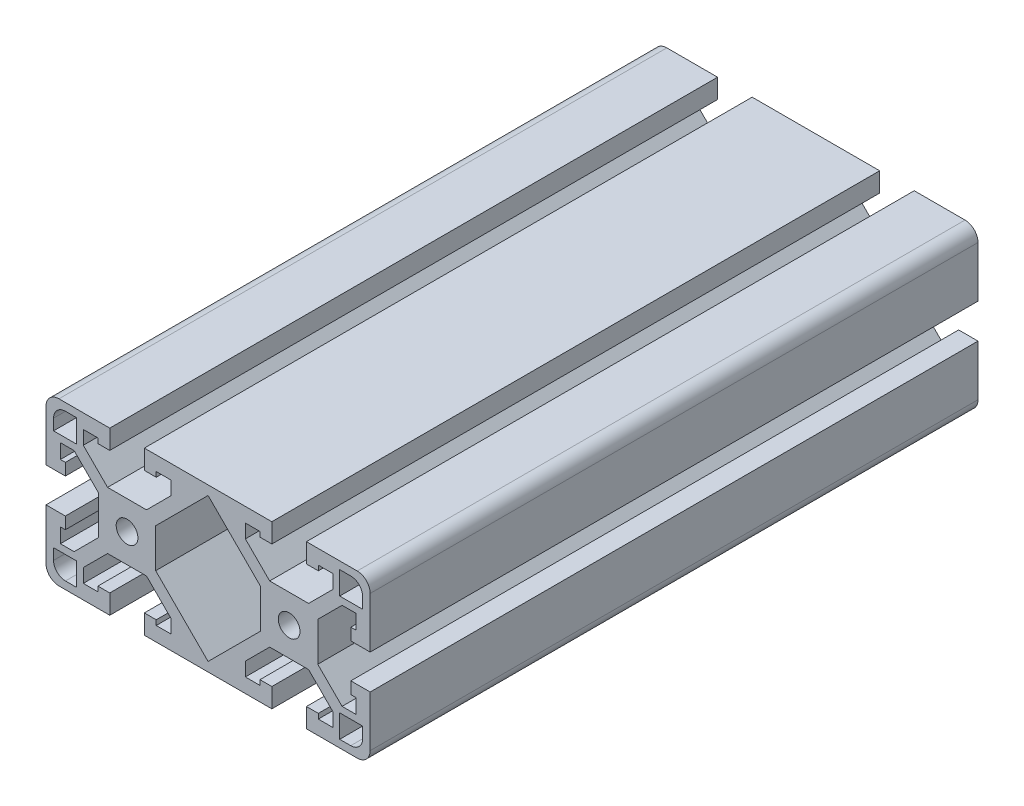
SolidWorks part; units mm, degrees
ref_plane "Front" through (0, 0, 0) normal (0, 0, 1) x (1, 0, 0)
ref_plane "Top" through (0, 0, 0) normal (0, 1, 0) x (1, 0, 0)
ref_plane "Right" through (0, 0, 0) normal (1, 0, 0) x (0, 0, -1)
sketch "Sketch1" plane through (0, 0, 0) normal (0, 0, 1) x (1, 0, 0)
  line L0 (-12.319, 4.5757) -> (-12.319, -4.5757)
  line L1 (0, 16.8947) -> (-12.319, 4.5757)
  line L2 (12.319, 4.5757) -> (0, 16.8947)
  line L3 (12.319, -4.5757) -> (12.319, 4.5757)
  line L4 (0, -16.8947) -> (12.319, -4.5757)
  line L5 (-12.319, -4.5757) -> (0, -16.8947)
  line L6 (-30.9372, 11.8872) -> (-30.9372, 17.272)
  line L7 (-36.322, 11.8872) -> (-30.9372, 11.8872)
  line L8 (-36.322, 14.478) -> (-36.322, 11.8872)
  line L9 (-30.9372, 17.272) -> (-33.528, 17.272)
  line L10 (-30.9372, -17.272) -> (-30.9372, -11.8872)
  line L11 (-33.528, -17.272) -> (-30.9372, -17.272)
  line L12 (-36.322, -11.8872) -> (-36.322, -14.478)
  line L13 (-30.9372, -11.8872) -> (-36.322, -11.8872)
  line L14 (36.322, -11.8872) -> (30.9372, -11.8872)
  line L15 (36.322, -14.478) -> (36.322, -11.8872)
  line L16 (30.9372, -17.272) -> (33.528, -17.272)
  line L17 (30.9372, -11.8872) -> (30.9372, -17.272)
  line L18 (30.9372, 17.272) -> (30.9372, 11.8872)
  line L19 (33.528, 17.272) -> (30.9372, 17.272)
  line L20 (36.322, 11.8872) -> (36.322, 14.478)
  line L21 (30.9372, 11.8872) -> (36.322, 11.8872)
  line L22 (-29.337, 12.4423) -> (-29.337, 15.6718)
  line L23 (-29.337, 15.6718) -> (-25.908, 15.6718)
  line L24 (-25.908, 15.6718) -> (-25.908, 14.5034)
  line L25 (-25.908, 14.5034) -> (-23.114, 14.5034)
  line L26 (-23.114, 14.5034) -> (-23.114, 19.05)
  line L27 (-23.114, 19.05) -> (-35.052, 19.05)
  line L28 (-38.1, 16.002) -> (-38.1, 4.064)
  line L29 (-38.1, 4.064) -> (-33.5534, 4.064)
  line L30 (-33.5534, 4.064) -> (-33.5534, 6.858)
  line L31 (-33.5534, 6.858) -> (-34.7218, 6.858)
  line L32 (-34.7218, 6.858) -> (-34.7218, 10.287)
  line L33 (-34.7218, 10.287) -> (-31.4923, 10.287)
  line L34 (-31.4923, 10.287) -> (-25.781, 4.5757)
  line L35 (-25.781, 4.5757) -> (-25.781, -4.5757)
  line L36 (-25.781, -4.5757) -> (-31.4923, -10.287)
  line L37 (-31.4923, -10.287) -> (-34.7218, -10.287)
  line L38 (-34.7218, -10.287) -> (-34.7218, -6.858)
  line L39 (-34.7218, -6.858) -> (-33.5534, -6.858)
  line L40 (-33.5534, -6.858) -> (-33.5534, -4.064)
  line L41 (-33.5534, -4.064) -> (-38.1, -4.064)
  line L42 (-38.1, -4.064) -> (-38.1, -16.002)
  line L43 (-35.052, -19.05) -> (-23.114, -19.05)
  line L44 (-23.114, -19.05) -> (-23.114, -14.5034)
  line L45 (-23.114, -14.5034) -> (-25.908, -14.5034)
  line L46 (-25.908, -14.5034) -> (-25.908, -15.6718)
  line L47 (-25.908, -15.6718) -> (-29.337, -15.6718)
  line L48 (-29.337, -15.6718) -> (-29.337, -12.4423)
  line L49 (-29.337, -12.4423) -> (-23.6257, -6.731)
  line L50 (-23.6257, -6.731) -> (-14.4743, -6.731)
  line L51 (-14.4743, -6.731) -> (-8.763, -12.4423)
  line L52 (-8.763, -12.4423) -> (-8.763, -15.6718)
  line L53 (-8.763, -15.6718) -> (-12.192, -15.6718)
  line L54 (-12.192, -15.6718) -> (-12.192, -14.5034)
  line L55 (-12.192, -14.5034) -> (-14.986, -14.5034)
  line L56 (-14.986, -14.5034) -> (-14.986, -19.05)
  line L57 (-14.986, -19.05) -> (14.986, -19.05)
  line L58 (14.986, -19.05) -> (14.986, -14.5034)
  line L59 (14.986, -14.5034) -> (12.192, -14.5034)
  line L60 (12.192, -14.5034) -> (12.192, -15.6718)
  line L61 (12.192, -15.6718) -> (8.763, -15.6718)
  line L62 (8.763, -15.6718) -> (8.763, -12.4423)
  line L63 (8.763, -12.4423) -> (14.4743, -6.731)
  line L64 (14.4743, -6.731) -> (23.6257, -6.731)
  line L65 (23.6257, -6.731) -> (29.337, -12.4423)
  line L66 (29.337, -12.4423) -> (29.337, -15.6718)
  line L67 (29.337, -15.6718) -> (25.908, -15.6718)
  line L68 (25.908, -15.6718) -> (25.908, -14.5034)
  line L69 (25.908, -14.5034) -> (23.114, -14.5034)
  line L70 (23.114, -14.5034) -> (23.114, -19.05)
  line L71 (23.114, -19.05) -> (35.052, -19.05)
  line L72 (38.1, -16.002) -> (38.1, -4.064)
  line L73 (38.1, -4.064) -> (33.5534, -4.064)
  line L74 (33.5534, -4.064) -> (33.5534, -6.858)
  line L75 (33.5534, -6.858) -> (34.7218, -6.858)
  line L76 (34.7218, -6.858) -> (34.7218, -10.287)
  line L77 (34.7218, -10.287) -> (31.4923, -10.287)
  line L78 (31.4923, -10.287) -> (25.781, -4.5757)
  line L79 (25.781, -4.5757) -> (25.781, 4.5757)
  line L80 (25.781, 4.5757) -> (31.4923, 10.287)
  line L81 (31.4923, 10.287) -> (34.7218, 10.287)
  line L82 (34.7218, 10.287) -> (34.7218, 6.858)
  line L83 (34.7218, 6.858) -> (33.5534, 6.858)
  line L84 (33.5534, 6.858) -> (33.5534, 4.064)
  line L85 (33.5534, 4.064) -> (38.1, 4.064)
  line L86 (38.1, 4.064) -> (38.1, 16.002)
  line L87 (35.052, 19.05) -> (23.114, 19.05)
  line L88 (23.114, 19.05) -> (23.114, 14.5034)
  line L89 (23.114, 14.5034) -> (25.908, 14.5034)
  line L90 (25.908, 14.5034) -> (25.908, 15.6718)
  line L91 (25.908, 15.6718) -> (29.337, 15.6718)
  line L92 (29.337, 15.6718) -> (29.337, 12.4423)
  line L93 (29.337, 12.4423) -> (23.6257, 6.731)
  line L94 (23.6257, 6.731) -> (14.4743, 6.731)
  line L95 (14.4743, 6.731) -> (8.763, 12.4423)
  line L96 (8.763, 12.4423) -> (8.763, 15.6718)
  line L97 (8.763, 15.6718) -> (12.192, 15.6718)
  line L98 (12.192, 15.6718) -> (12.192, 14.5034)
  line L99 (12.192, 14.5034) -> (14.986, 14.5034)
  line L100 (14.986, 14.5034) -> (14.986, 19.05)
  line L101 (14.986, 19.05) -> (-14.986, 19.05)
  line L102 (-14.986, 19.05) -> (-14.986, 14.5034)
  line L103 (-14.986, 14.5034) -> (-12.192, 14.5034)
  line L104 (-12.192, 14.5034) -> (-12.192, 15.6718)
  line L105 (-12.192, 15.6718) -> (-8.763, 15.6718)
  line L106 (-8.763, 15.6718) -> (-8.763, 12.4423)
  line L107 (-8.763, 12.4423) -> (-14.4743, 6.731)
  line L108 (-14.4743, 6.731) -> (-23.6257, 6.731)
  line L109 (-23.6257, 6.731) -> (-29.337, 12.4423)
  circle A0 centre (-19.05, 0) radius 2.5527
  circle A1 centre (19.05, 0) radius 2.5527
  arc A2 (-35.052, 19.05) -> (-38.1, 16.002) centre (-35.052, 16.002) ccw
  arc A3 (-38.1, -16.002) -> (-35.052, -19.05) centre (-35.052, -16.002) ccw
  arc A4 (35.052, -19.05) -> (38.1, -16.002) centre (35.052, -16.002) ccw
  arc A5 (38.1, 16.002) -> (35.052, 19.05) centre (35.052, 16.002) ccw
  arc A6 (-33.528, 17.272) -> (-36.322, 14.478) centre (-33.528, 14.478) ccw
  arc A7 (-36.322, -14.478) -> (-33.528, -17.272) centre (-33.528, -14.478) ccw
  arc A8 (33.528, -17.272) -> (36.322, -14.478) centre (33.528, -14.478) ccw
  arc A9 (36.322, 14.478) -> (33.528, 17.272) centre (33.528, 14.478) ccw
extrude "Boss-Extrude1" add sketch "Sketch1" along normal mid plane 142.875
